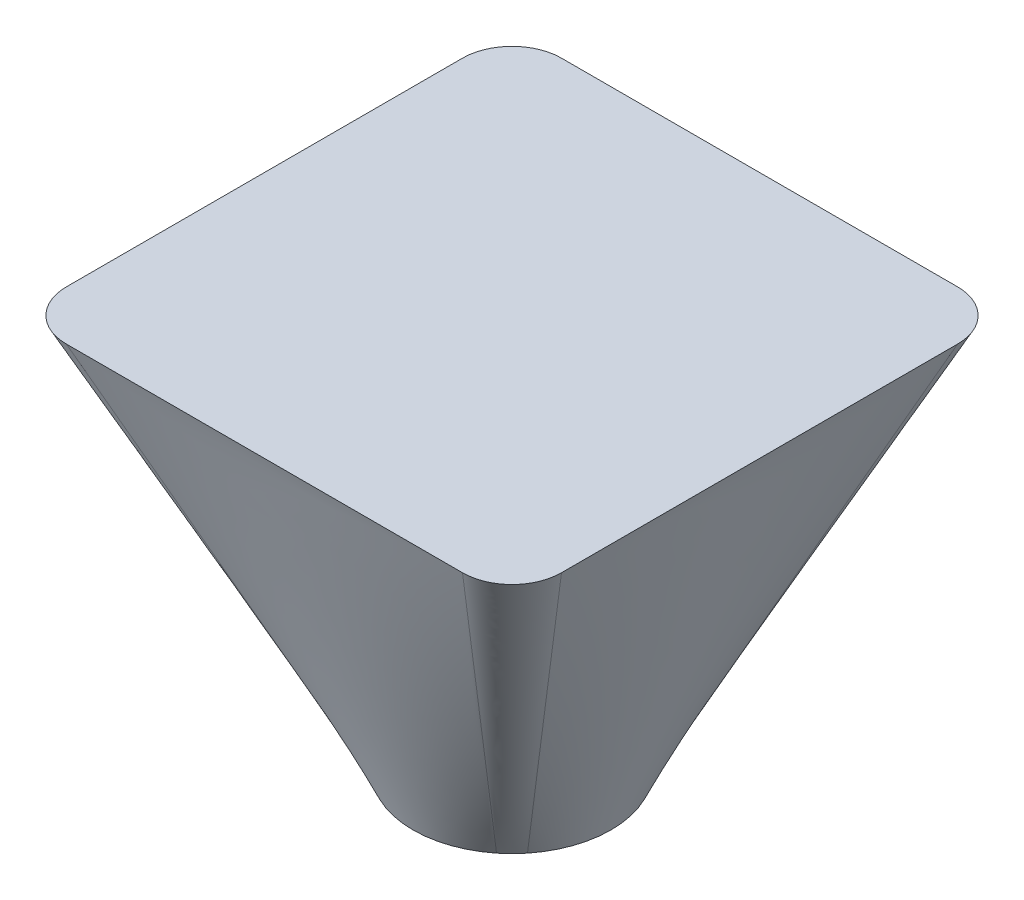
SolidWorks part; units mm, degrees
ref_plane "Ebene vorne" through (0, 0, 0) normal (0, 0, 1) x (1, 0, 0)
ref_plane "Ebene oben" through (0, 0, 0) normal (0, 1, 0) x (1, 0, 0)
ref_plane "Ebene rechts" through (0, 0, 0) normal (1, 0, 0) x (0, 0, -1)
sketch "Skizze1" plane through (0, 0, 0) normal (0, 1, 0) x (1, 0, 0)
  line L1 (-40, -50) -> (40, -50)
  line L2 (-50, -40) -> (-50, 40)
  line L3 (-40, 50) -> (40, 50)
  line L4 (50, -40) -> (50, 40)
  line L5 (-50, -50) -> (50, 50) construction
  line L6 (-50, 50) -> (50, -50) construction
  arc A0 (-50, 40) -> (-40, 50) centre (-40, 40) cw
  arc A1 (40, 50) -> (50, 40) centre (40, 40) cw
  arc A2 (40, -50) -> (50, -40) centre (40, -40) ccw
  arc A3 (-40, -50) -> (-50, -40) centre (-40, -40) cw
  point P0 (0, 0)
  dimension "D3" = 10
  dimension "D1" = 100
  dimension "D2" = 100
ref_plane "Ebene1" through (0, -80, 0) normal (0, 1, 0) x (-1, 0, 0)
sketch "Skizze2" plane through (0, -80, 0) normal (0, 1, 0) x (-1, 0, 0)
  line L0 (0, 0) -> (-40, 50) construction
  line L1 (0, 0) -> (-50, 40) construction
  line L2 (0, 0) -> (40, 50) construction
  line L3 (0, 0) -> (50, 40) construction
  line L4 (0, 0) -> (50, -40) construction
  line L5 (40, -50) -> (0, 0) construction
  line L6 (-50, -40) -> (0, 0) construction
  line L7 (-40, -50) -> (0, 0) construction
  arc A0 (-15.6174, 12.4939) -> (-15.6174, -12.4939) centre (0, 0) ccw
  arc A1 (-12.4939, 15.6174) -> (-15.6174, 12.4939) centre (0, 0) ccw
  arc A2 (12.4939, 15.6174) -> (-12.4939, 15.6174) centre (0, 0) ccw
  arc A3 (15.6174, 12.4939) -> (12.4939, 15.6174) centre (0, 0) ccw
  arc A4 (15.6174, -12.4939) -> (15.6174, 12.4939) centre (0, 0) ccw
  arc A5 (12.4939, -15.6174) -> (15.6174, -12.4939) centre (0, 0) ccw
  arc A6 (-12.4939, -15.6174) -> (12.4939, -15.6174) centre (0, 0) ccw
  arc A7 (-15.6174, -12.4939) -> (-12.4939, -15.6174) centre (0, 0) ccw
  dimension "D1" = 40
loft "Ausformung1" add profiles "Skizze2", "Skizze1"
